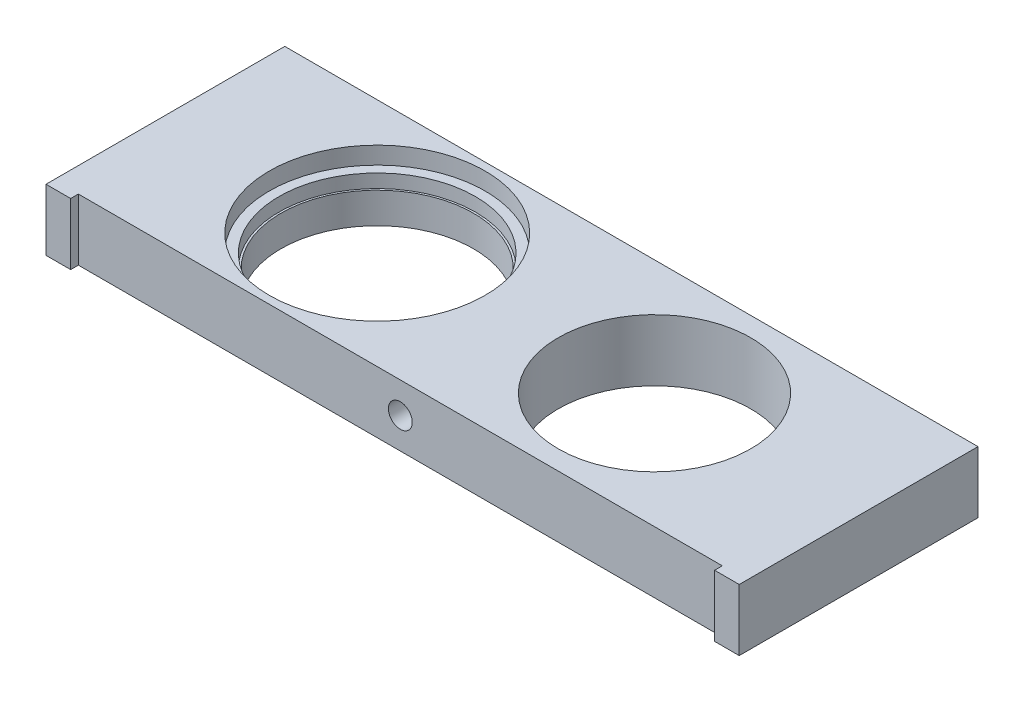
SolidWorks part; units mm, degrees
ref_plane "Front Plane" through (0, 0, 0) normal (0, 0, 1) x (1, 0, 0)
ref_plane "Top Plane" through (0, 0, 0) normal (0, 1, 0) x (1, 0, 0)
ref_plane "Right Plane" through (0, 0, 0) normal (1, 0, 0) x (0, 0, -1)
sketch "Sketch1" plane through (0, 0, 0) normal (1, 0, 0) x (0, 0, -1)
  line L1 (-15, -4) -> (15, -4)
  line L2 (-15, -4) -> (-15, 4)
  line L3 (-15, 4) -> (15, 4)
  line L4 (15, -4) -> (15, 4)
  line L5 (-15, -4) -> (15, 4) construction
  line L6 (-15, 4) -> (15, -4) construction
  point P0 (0, 0)
  dimension "D1" = 30
  dimension "D2" = 8
extrude "Boss-Extrude1" add sketch "Sketch1" along normal mid plane 90
sketch "Sketch2" plane through (0, 4, 0) normal (0, 1, 0) x (1, 0, 0)
  line L0 (-45, 0) -> (-18, 0) construction
  line L1 (-45, 15) -> (-45, -15) construction
  line L2 (-18, 0) -> (0, 0) construction
  line L3 (0, 0) -> (18, 0) construction
  line L4 (18, 0) -> (45, 0) construction
  line L5 (45, 15) -> (45, -15) construction
  circle A0 centre (-18, 0) radius 12.5
  circle A1 centre (18, 0) radius 12.5
  dimension "D1" = 25
  dimension "D2" = 25
  dimension "D3" = 18
extrude "Cut-Extrude1" cut sketch "Sketch2" against normal through all
sketch "Sketch3" plane through (0, 4, 0) normal (0, 1, 0) x (1, 0, 0)
  line L0 (-18, 12.5) -> (-18, 0) construction
  line L1 (-18, 0) -> (-30.5, 0) construction
  circle A0 centre (-18, 0) radius 12.5 construction
  circle A1 centre (-18, 0) radius 12.75
  dimension "D1" = 25.5
extrude "Cut-Extrude2" cut sketch "Sketch3" against normal blind 4
sketch "Sketch4" plane through (0, 4, 0) normal (0, 1, 0) x (1, 0, 0)
  circle A0 centre (-18, 0) radius 14
  dimension "D1" = 28
extrude "Cut-Extrude3" cut sketch "Sketch4" against normal blind 2.25
hole_wizard "M3x0.5 Tapped Hole1" positions "Sketch7" profile "Sketch6" tap size "M3x0.5" standard "ANSI Metric"
sketch "Sketch7" plane through (-45, 0, 0) normal (-1, 0, 0) x (0, 0, 1)
  line L4 (-15, 4) -> (15, 4) construction
  line L5 (15, 4) -> (15, -4) construction
  point P0 (0, 0)
  dimension "D1" = 4
  dimension "D2" = 15
sketch "Sketch6" plane through (-45, 0, 0) normal (0, 1, 0) x (0, 0, 1)
  line L0 (0, 0) -> (0, 7.7511)
  line L1 (0, 7.7511) -> (1.25, 7)
  line L2 (1.25, 7) -> (1.25, 0)
  line L5 (1.25, 0) -> (0, 0)
  line L10 (0, 7.7511) -> (-1.25, 7) construction
  line L11 (0, -6.35) -> (0, 107.95) construction
  dimension "Tap Drill Dia." = 2.5
  dimension "Tap Drill Depth" = 7
  dimension "Drill Angle" = 118
sketch "Sketch8" plane through (0, 0, 15) normal (0, 0, 1) x (1, 0, 0)
  line L0 (45, 4) -> (-45, 4) construction
  line L1 (-45, -4) -> (-41.8, -4)
  line L2 (-45, -4) -> (-45, 4)
  line L3 (-45, 4) -> (-41.8, 4)
  line L4 (-41.8, -4) -> (-41.8, 4)
  line L6 (45, -4) -> (41.8, -4)
  line L7 (45, -4) -> (45, 4)
  line L8 (45, 4) -> (41.8, 4)
  line L9 (41.8, -4) -> (41.8, 4)
  dimension "D1" = 3.2
extrude "Boss-Extrude2" add sketch "Sketch8" along normal blind 1
hole_wizard "Ø3.1 (3.1) Diameter Hole1" positions "Sketch10" profile "Sketch9" hole size "Ø3.1" standard "ANSI Metric"
sketch "Sketch10" plane through (0, 0, 15) normal (0, 0, 1) x (1, 0, 0)
  point P0 (0, 0)
sketch "Sketch9" plane through (0, 0, 15) normal (1, 0, 0) x (0, -1, 0)
  line L0 (0, 0) -> (0, 10.9313)
  line L1 (0, 10.9313) -> (1.55, 10)
  line L2 (1.55, 10) -> (1.55, 0)
  line L5 (1.55, 0) -> (0, 0)
  line L10 (0, 10.9313) -> (-1.55, 10) construction
  line L11 (0, -6.35) -> (0, 107.95) construction
  dimension "Hole Dia." = 3.1
  dimension "Hole Depth" = 10
  dimension "Drill Angle" = 118
